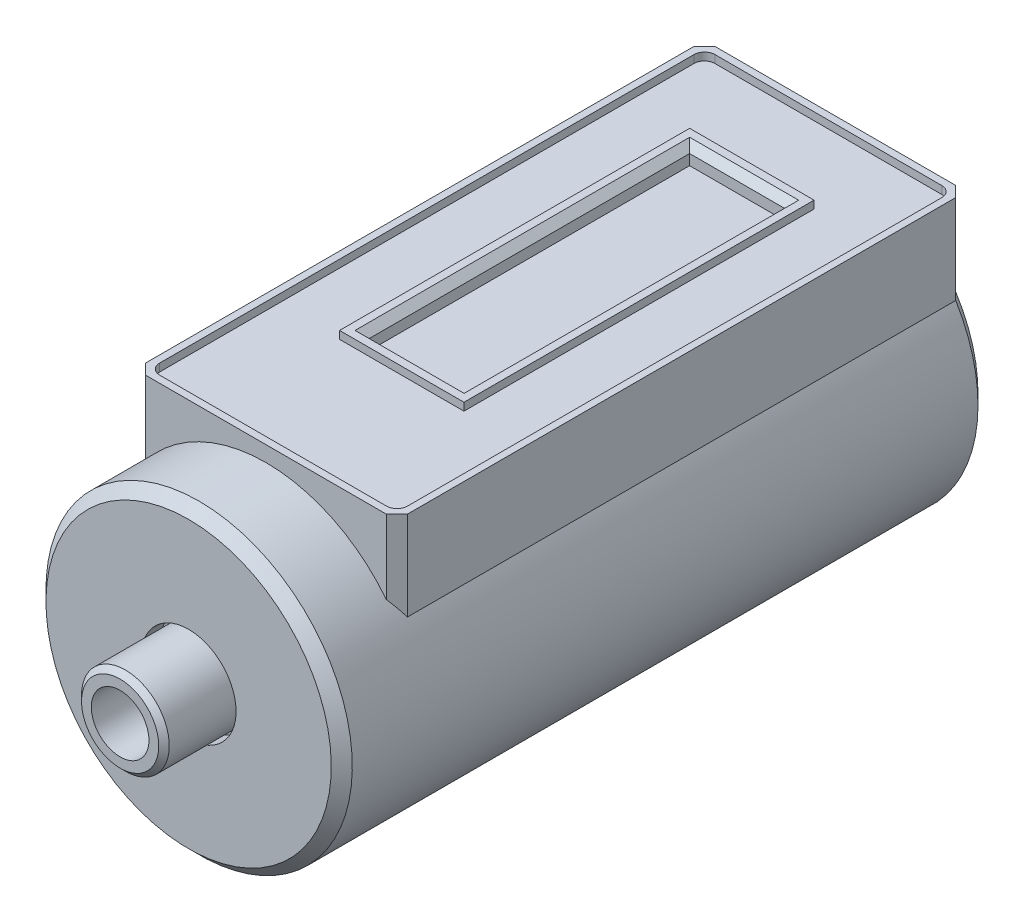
SolidWorks part; units mm, degrees
ref_plane "Front" through (0, 0, 0) normal (0, 0, 1) x (1, 0, 0)
ref_plane "Top" through (0, 0, 0) normal (0, 1, 0) x (1, 0, 0)
ref_plane "Right" through (0, 0, 0) normal (1, 0, 0) x (0, 0, -1)
sketch "Sketch2" plane through (0, 0, 0) normal (1, 0, 0) x (0, 0, -1)
  line L0 (4.31, 0) -> (4.31, 2.79)
  line L1 (4.69, 3.17) -> (10.53, 3.17)
  line L2 (9.26, 3.43) -> (9.26, 10.31)
  line L3 (10.02, 11.07) -> (56, 11.07)
  line L4 (56, 11.07) -> (56, 0)
  line L5 (56, 0) -> (4.31, 0)
  line L6 (9.26, 3.43) -> (10.53, 3.43)
  line L7 (10.53, 3.43) -> (10.53, 3.17)
  line L8 (4.31, 2.79) -> (4.69, 3.17)
  line L9 (9.26, 10.31) -> (10.02, 11.07)
  point P5 (0, 0)
  point P12 (27.9186, 1.7463)
  dimension "D1" = 51.69
  dimension "D2" = 3.17
  dimension "D3" = 11.07
  dimension "D4" = 4.95
  dimension "D5" = 1.27
  dimension "D6" = 3.43
  dimension "D7" = 2.79
  dimension "D8" = 0.38
  dimension "D9" = 0.76
  dimension "D10" = 10.31
  dimension "D11" = 56
revolve "Revolve1" add sketch "Sketch2" angle 360 about L5
sketch "Sketch3" plane through (0, 0, 0) normal (0, 1, 0) x (1, 0, 0)
  line L0 (11.07, 56) -> (-11.07, 56) construction
  line L1 (-9.46, 56) -> (9.46, 56)
  line L2 (-9.46, 56) -> (-9.46, 15.61)
  line L3 (-8.7, 14.85) -> (8.7, 14.85)
  line L4 (9.46, 56) -> (9.46, 15.61)
  line L5 (-9.46, 15.61) -> (-8.7, 14.85)
  line L6 (9.46, 15.61) -> (8.7, 14.85)
  point P1 (9.46, 14.85)
  point P2 (-9.46, 14.85)
  point P6 (0, 14.85)
  dimension "D1" = 41.15
  dimension "D2" = 18.92
extrude "Extrude1" add sketch "Sketch3" along normal blind 12.19
chamfer "Chamfer1" distance 0.76 angle 45 3 edges at (-9.46, 8.9696, -56) (0, -11.07, -56) (9.46, 8.9696, -56)
sketch "Sketch4" plane through (0, 12.19, 0) normal (0, 1, 0) x (1, 0, 0)
  line L0 (-8.7, 14.85) -> (8.7, 14.85) construction
  line L1 (-8.19, 55.49) -> (8.2, 55.49)
  line L2 (-8.95, 54.73) -> (-8.95, 16.12)
  line L3 (-8.19, 15.36) -> (8.2, 15.36)
  line L4 (8.96, 54.73) -> (8.96, 16.12)
  line L5 (-9.46, 15.61) -> (-9.46, 55.24) construction
  line L7 (-4.49, 49.96) -> (4.5, 49.96)
  line L8 (-4.49, 49.96) -> (-4.49, 24.66)
  line L9 (-4.49, 24.66) -> (4.5, 24.66)
  line L10 (4.5, 49.96) -> (4.5, 24.66)
  arc A0 (-8.95, 54.73) -> (-8.19, 55.49) centre (-8.19, 54.73) cw
  arc A1 (8.96, 54.73) -> (8.2, 55.49) centre (8.2, 54.73) ccw
  arc A2 (8.96, 16.12) -> (8.2, 15.36) centre (8.2, 16.12) cw
  arc A3 (-8.95, 16.12) -> (-8.19, 15.36) centre (-8.19, 16.12) ccw
  dimension "D5" = 0.76
  dimension "D1" = 17.91
  dimension "D2" = 40.13
  dimension "D3" = 0.51
  dimension "D4" = 0.51
  dimension "D6" = 5.53
  dimension "D7" = 4.46
  dimension "D8" = 4.46
  dimension "D9" = 25.3
extrude "Cut-Extrude1" cut sketch "Sketch4" against normal blind 0.56
sketch "Sketch5" plane through (0, 12.19, 0) normal (0, 1, 0) x (1, 0, 0)
  line L1 (-3.42, 48.89) -> (3.44, 48.89)
  line L2 (-3.42, 48.89) -> (-3.42, 25.73)
  line L3 (-3.42, 25.73) -> (3.44, 25.73)
  line L4 (3.44, 48.89) -> (3.44, 25.73)
  line L6 (4.5, 49.96) -> (-4.49, 49.96) construction
  line L7 (-4.49, 49.96) -> (-4.49, 24.66) construction
  point P4 (0.005, 49.96)
  dimension "D1" = 6.86
  dimension "D2" = 23.16
  dimension "D3" = 1.07
  dimension "D4" = 1.07
extrude "Cut-Extrude2" cut sketch "Sketch5" against normal blind 1.27
chamfer "Chamfer2" distance 0.51 angle 45 4 edges at (0.01, 12.19, -25.73) (3.44, 12.19, -37.31) (-3.42, 12.19, -37.31) (0.01, 12.19, -48.89)
hole_wizard "Hole1" positions "Sketch7" profile "Sketch6" legacy
sketch "Sketch7" plane through (0, 0, -4.31) normal (0, 0, 1) x (1, 0, 0)
  circle A0 centre (0, 0) radius 3.17 construction
  point P0 (0, 0)
sketch "Sketch6" plane through (0, 0, -4.31) normal (1, 0, 0) x (0, -1, 0)
  line L0 (0, 0) -> (0, 7.6015)
  line L1 (0, 7.6015) -> (2.0828, 6.35)
  line L2 (2.0828, 6.35) -> (2.0828, 0)
  line L4 (2.0828, 0) -> (0, 0)
  line L6 (0, 7.6015) -> (-2.0828, 6.35) construction
  line L7 (0, -4.2442) -> (0, 117.3081) construction
  dimension "Diameter" = 4.1656
  dimension "Depth" = 6.35
  dimension "Drill Angle" = 118
